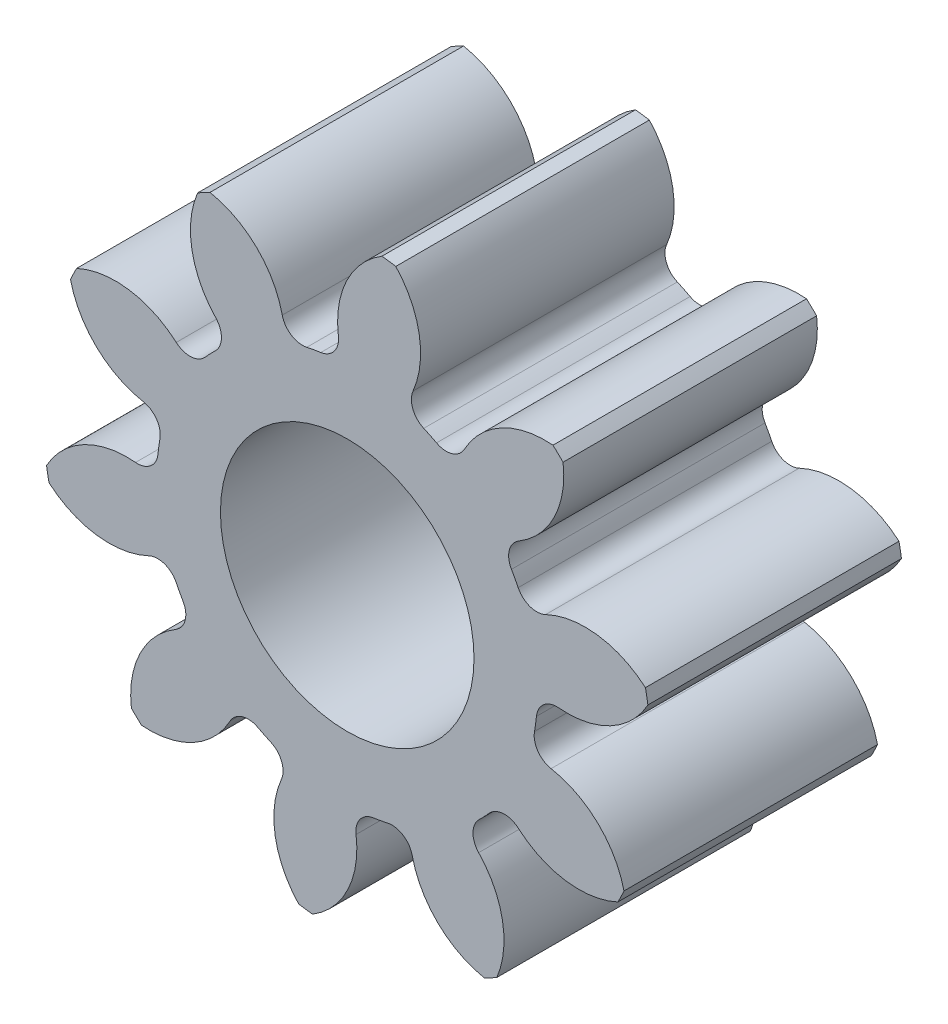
SolidWorks part; units mm, degrees
ref_plane "Front" through (0, 0, 0) normal (0, 0, 1) x (1, 0, 0)
ref_plane "Top" through (0, 0, 0) normal (0, 1, 0) x (1, 0, 0)
ref_plane "Right" through (0, 0, 0) normal (1, 0, 0) x (0, 0, -1)
sketch "Sketch3" plane through (0, 0, 0) normal (0, 0, 1) x (1, 0, 0)
  circle A0 centre (0, 0) radius 121.92
  dimension "od" = 243.84
extrude "gearBody" add sketch "Sketch3" along normal blind 101.6
sketch "Sketch2" plane through (0, 0, 0) normal (0, 0, 1) x (1, 0, 0)
  line L0 (0, 0) -> (88.2053, 36.5358) construction
  line L1 (111.4989, -53.8321) -> (0, 0) construction
  line L2 (0, 0) -> (36.3143, 0) construction
  line L3 (101.5771, 2.1593) -> (97.184, -29.6282) construction
  line L5 (99.3805, -13.7345) -> (0, 0) construction
  line L7 (0, 0) -> (95.4728, 0) construction
  arc A0 (95.472, 0.3731) -> (91.7923, -26.2532) centre (0, 0) ccw construction
  arc A1 (120.4806, 18.6792) -> (110.8984, -50.656) centre (0, 0) ccw construction
  arc A2 (101.5771, 2.1593) -> (97.184, -29.6282) centre (0, 0) ccw construction
  arc A3 (75.0399, -13.2458) -> (75.8197, -7.6031) centre (0, 0) ccw
  arc A4 (111.4989, -53.8321) -> (81.6835, -22.8163) centre (74.9898, -59.0896) ccw
  arc A5 (111.4989, -53.8321) -> (121.92, 21.5734) centre (0, 0) ccw
  arc A6 (121.92, 21.5734) -> (84.81, -0.1932) centre (88.2053, 36.5358) cw
  arc A7 (75.8197, -7.6031) -> (84.81, -0.1932) centre (84.0487, -8.4283) cw
  arc A8 (81.6835, -22.8163) -> (75.0399, -13.2458) centre (83.1842, -14.6834) cw
  point P6 (121.92, 21.5734)
  point P22 (111.4989, -53.8321)
  dimension "baseDia" = 190.9455
  dimension "od" = 243.84
  dimension "pd" = 203.2
  dimension "rd" = 152.4
  dimension "rFillet" = 8.2702
  dimension "pointX" = 121.92
  dimension "pointY" = 21.5734
  dimension "CTT" = 31.7875
  dimension "flankCenterAngle" = 22.5
extrude "toothCut" cut sketch "Sketch2" along normal through all
pattern_circular "CirPattern1" count 10 over 360 about axis through (0, 0, 0) along (0, 0, 1) of "toothCut"
sketch "hub1Dia" plane through (0, 0, 0) normal (0, 0, -1) x (-1, 0, 0)
  circle A0 centre (0, 0) radius 12.7
  dimension "hub1Dia" = 25.4
sketch "hub2Dia" plane through (0, 0, 101.6) normal (0, 0, 1) x (1, 0, 0)
  circle A0 centre (0, 0) radius 12.7
  dimension "hub2dia" = 25.4
sketch "boreDia" plane through (0, 0, 0) normal (0, 0, 1) x (1, 0, 0)
  circle A0 centre (0, 0) radius 50.8
  dimension "boreDia" = 101.6
extrude "bore" cut sketch "boreDia" against normal mid plane 25400
